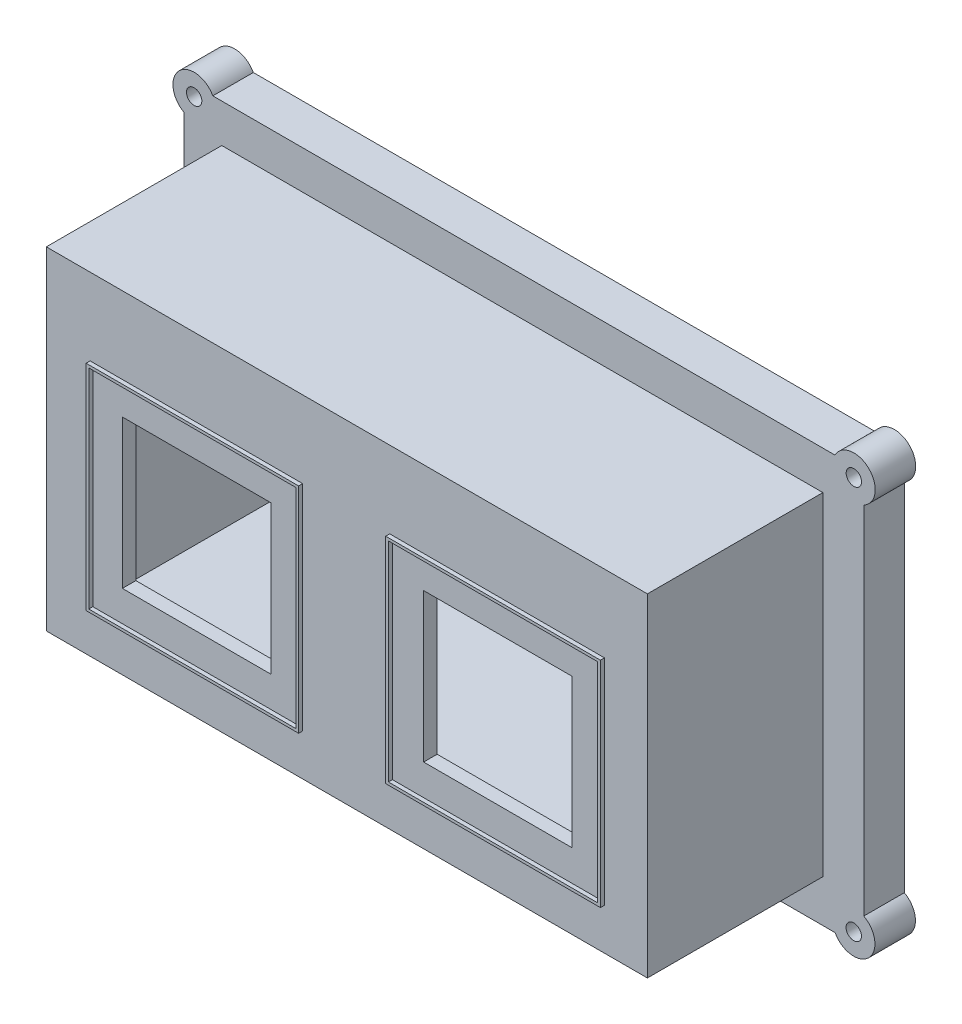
SolidWorks part; units mm, degrees
ref_plane "Front Plane" through (0, 0, 0) normal (0, 0, 1) x (1, 0, 0)
ref_plane "Top Plane" through (0, 0, 0) normal (0, 1, 0) x (1, 0, 0)
ref_plane "Right Plane" through (0, 0, 0) normal (1, 0, 0) x (0, 0, -1)
sketch "Sketch15" plane through (0, 0, 0) normal (0, 0, 1) x (1, 0, 0)
  line L1 (102.6627, 56.9988) -> (-40.9451, 56.9988)
  line L2 (102.6627, 56.9988) -> (102.6627, -32.1719)
  line L3 (102.6627, -32.1719) -> (-40.9451, -32.1719)
  line L4 (-40.9451, 56.9988) -> (-40.9451, -32.1719)
  line L12 (46.1992, 23.4046) -> (74.1392, 23.4046)
  line L33 (-24.8052, 43.9208) -> (88.3014, 43.9208)
  line L34 (-24.8052, 43.9208) -> (-24.8052, -18.6767)
  line L35 (-24.8052, -18.6767) -> (88.3014, -18.6767)
  line L36 (88.3014, 43.9208) -> (88.3014, -18.6767)
  line L53 (-10.4965, 23.3508) -> (17.4435, 23.3508)
  line L54 (-10.4965, 23.3508) -> (-10.4965, -4.5892)
  line L55 (-10.4965, -4.5892) -> (17.4435, -4.5892)
  line L56 (17.4435, 23.3508) -> (17.4435, -4.5892)
  line L58 (46.1992, 23.4046) -> (46.1992, -4.5354)
  line L59 (46.1992, -4.5354) -> (74.1392, -4.5354)
  line L60 (74.1392, 23.4046) -> (74.1392, -4.5354)
extrude "Boss-Extrude5" add sketch "Sketch15" along normal blind 2.54 contours L36 L33 L34 L35 L53 L56 L55 L54 L12 L60 L59 L58
sketch "Sketch16" plane through (0, 0, 0) normal (0, 0, 1) x (1, 0, 0)
  line L1 (102.6627, 56.9988) -> (-40.9451, 56.9988)
  line L2 (102.6627, 56.9988) -> (102.6627, -32.1719)
  line L3 (102.6627, -32.1719) -> (-40.9451, -32.1719)
  line L4 (-40.9451, 56.9988) -> (-40.9451, -32.1719)
  line L61 (-16.5601, 29.4581) -> (23.4411, 29.4581)
  line L62 (-16.5601, 29.4581) -> (-16.5601, -10.8512)
  line L63 (-16.0521, 28.9501) -> (22.9331, 28.9501)
  line L64 (-16.0521, 28.9501) -> (-16.0521, -10.3432)
  line L65 (-16.0521, -10.3432) -> (22.9331, -10.3432)
  line L66 (22.9331, 28.9501) -> (22.9331, -10.3432)
  line L67 (40.3199, 28.9501) -> (79.7199, 28.9501)
  line L68 (40.3199, 28.9501) -> (40.3199, -10.3432)
  line L69 (40.3199, -10.3432) -> (79.7199, -10.3432)
  line L70 (79.7199, 28.9501) -> (79.7199, -10.3432)
  line L71 (-16.5601, -10.8512) -> (23.4411, -10.8512)
  line L72 (23.4411, 29.4581) -> (23.4411, -10.8512)
  line L77 (39.8119, 29.4572) -> (80.2279, 29.4572)
  line L78 (39.8119, 29.4572) -> (39.8119, -10.8621)
  line L79 (39.8119, -10.8621) -> (80.2279, -10.8621)
  line L80 (80.2279, 29.4572) -> (80.2279, -10.8621)
extrude "Boss-Extrude6" add sketch "Sketch16" along normal blind 3.302 contours L72 L61 L62 L71 L63 L66 L65 L64 | L80 L77 L78 L79 L67 L70 L69 L68
sketch "Sketch27" plane through (0, 0, 0) normal (0, 0, -1) x (-1, 0, 0)
  line L9 (-96.0047, 51.1665) -> (31.8987, 51.1665) construction
  line L10 (-96.0047, 51.1665) -> (-96.0047, -26.6437) construction
  line L11 (-96.0047, -26.6437) -> (31.8987, -26.6437) construction
  line L12 (31.8987, 51.1665) -> (31.8987, -26.6437) construction
  point P4 (0, 0)
sketch "Sketch17" plane through (0, 0, 0) normal (0, 0, 1) x (1, 0, 0)
  line L1 (102.6627, 56.9988) -> (-40.9451, 56.9988)
  line L2 (102.6627, 56.9988) -> (102.6627, -32.1719)
  line L3 (102.6627, -32.1719) -> (-40.9451, -32.1719)
  line L4 (-40.9451, 56.9988) -> (-40.9451, -32.1719)
  line L29 (-22.2652, 41.3808) -> (85.7614, 41.3808)
  line L30 (-22.2652, 41.3808) -> (-22.2652, -16.1367)
  line L31 (-22.2652, -16.1367) -> (85.7614, -16.1367)
  line L32 (85.7614, 41.3808) -> (85.7614, -16.1367)
  line L33 (-24.8052, 43.9208) -> (88.3014, 43.9208)
  line L34 (-24.8052, 43.9208) -> (-24.8052, -18.6767)
  line L35 (-24.8052, -18.6767) -> (88.3014, -18.6767)
  line L36 (88.3014, 43.9208) -> (88.3014, -18.6767)
extrude "Boss-Extrude7" add sketch "Sketch17" against normal blind 38.1 contours L36 L33 L34 L35 L29 L32 L31 L30
sketch "Sketch18" plane through (0, 0, 0) normal (0, 0, 1) x (1, 0, 0)
  line L1 (102.674, 56.9988) -> (-40.9337, 56.9988)
  line L2 (102.674, 56.9988) -> (102.674, -32.1719)
  line L3 (102.674, -32.1719) -> (-40.9337, -32.1719)
  line L4 (-40.9337, 56.9988) -> (-40.9337, -32.1719)
  line L96 (88.3014, 43.9208) -> (88.3014, -18.6767) construction
  line L101 (-31.8987, 51.1665) -> (96.0047, 51.1665)
  line L102 (-31.8987, 51.1665) -> (-31.8987, -26.6437)
  line L103 (-31.8987, -26.6437) -> (96.0047, -26.6437)
  line L104 (96.0047, 51.1665) -> (96.0047, -26.6437)
  line L117 (-24.8052, 43.9208) -> (88.3014, 43.9208)
  line L118 (-24.8052, 43.9208) -> (-24.8052, -18.6767)
  line L119 (-24.8052, -18.6767) -> (88.3014, -18.6767)
  line L120 (88.3014, 43.9208) -> (88.3014, -18.6767)
  line L121 (-24.8052, -18.6767) -> (88.3014, -18.6767) construction
  point P14 (-31.8987, 51.1665)
  point P15 (96.0047, -26.6437)
extrude "Boss-Extrude8" add sketch "Sketch18" along normal blind 7.62 from offset 38.1 contours L104 L101 L102 L103 L117 L120 L119 L118
sketch "Sketch23" plane through (0, 0, -38.1) normal (0, 0, 1) x (1, 0, 0)
  line L13 (86.0518, 46.8016) -> (-21.9458, 46.8016)
  line L14 (91.6398, 41.2136) -> (91.6398, -16.6908)
  line L15 (86.0518, -22.2788) -> (-21.9458, -22.2788)
  line L16 (-27.5338, 41.2136) -> (-27.5338, -16.6908)
  arc A0 (86.0518, 46.8016) -> (91.6398, 41.2136) centre (86.0518, 41.2136) cw
  arc A1 (-27.5338, 41.2136) -> (-21.9458, 46.8016) centre (-21.9458, 41.2136) cw
  arc A2 (-21.9458, -22.2788) -> (-27.5338, -16.6908) centre (-21.9458, -16.6908) cw
  arc A3 (91.6398, -16.6908) -> (86.0518, -22.2788) centre (86.0518, -16.6908) cw
  dimension "D1" = 5.588
  dimension "D2" = 5.588
  dimension "D3" = 5.588
  dimension "D4" = 5.588
sketch "Sketch25" plane through (0, 23.3508, 0) normal (0, -1, 0) x (1, 0, 0)
  line L2 (-31.8987, -38.1) -> (96.0047, -38.1) construction
  line L4 (-21.9458, -38.1) -> (-27.5338, -38.1) construction
  line L7 (-29.3587, -38.1) -> (-25.8027, -38.1)
  line L8 (-29.3587, -38.1) -> (-29.3587, -36.449)
  line L9 (-29.1047, -36.195) -> (-26.0567, -36.195)
  line L10 (-25.8027, -38.1) -> (-25.8027, -36.449)
  arc A0 (-26.0567, -36.195) -> (-25.8027, -36.449) centre (-26.0567, -36.449) cw
  arc A1 (-29.1047, -36.195) -> (-29.3587, -36.449) centre (-29.1047, -36.449) ccw
  dimension "D1" = 0.254
ref_plane "Plane2" through (0, 30.8465, 0) normal (0, 1, 0) x (1, 0, 0)
sweep "Cut-Sweep2" cut profiles "Sketch25" path "Sketch23"
sketch "Sketch28" plane through (0, 0, -38.1) normal (0, 0, -1) x (-1, 0, 0)
  circle A1 centre (-94.1327, 49.2944) radius 1.4752 construction
  circle A2 centre (30.0072, 49.2752) radius 1.4478 construction
  circle A3 centre (30.0073, -24.7523) radius 1.4478 construction
  circle A7 centre (-94.112, -24.7537) radius 1.4478 construction
  circle A8 centre (30.0073, -24.7523) radius 3.9878
  circle A9 centre (30.0072, 49.2752) radius 3.9878
  circle A10 centre (-94.1327, 49.2944) radius 4.0152
  circle A11 centre (-94.112, -24.7537) radius 3.9878
extrude "Boss-Extrude9" add sketch "Sketch28" against normal blind 7.62
sketch "Sketch29" plane through (0, 0, -38.1) normal (0, 0, -1) x (-1, 0, 0)
  circle A0 centre (-94.112, -24.7537) radius 1.4478
  circle A1 centre (-94.1327, 49.2944) radius 1.4478
  circle A2 centre (30.0074, 49.2944) radius 1.4478
  circle A3 centre (30.0074, -24.7537) radius 1.4478
extrude "Cut-Extrude1" cut sketch "Sketch29" against normal blind 7.62
